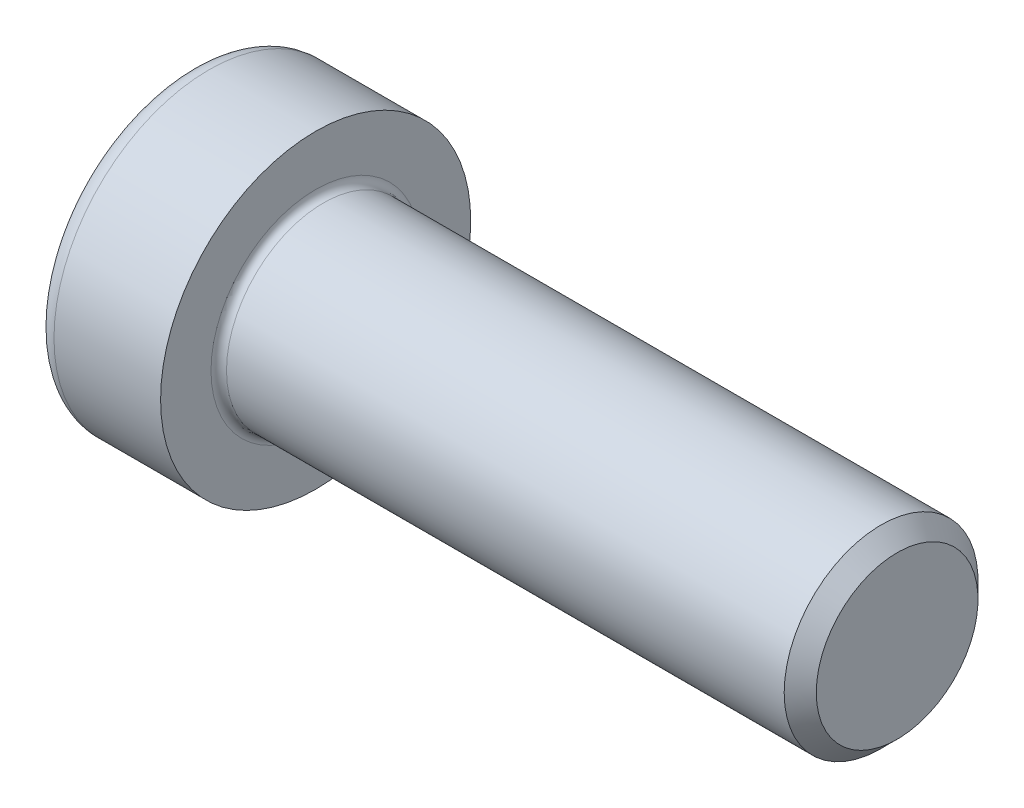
SolidWorks part; units mm, degrees
revolve "Base-Revolve" add sketch "BodySke"
sketch "BodySke" plane through (0, 0, 0) normal (0, 0, 1) x (1, 0, 0)
  line L0 (0, 0) -> (0, 8)
  line L1 (0, 8) -> (6.5, 8)
  line L2 (6.5, 8) -> (6.5, 5)
  line L3 (6.5, 5) -> (35.672, 5)
  line L4 (36.5, 4.172) -> (36.5, 0)
  line L5 (36.5, 0) -> (0, 0)
  line L6 (-31.75, 0) -> (127, 0) construction
  line L8 (36.5, 4.172) -> (35.672, 5)
  line L10 (36.5, -4.172) -> (35.672, -5) construction
  line L11 (8, 4.525) -> (8, -1.825) construction
  line L12 (6.5, 4.525) -> (6.5, -1.825) construction
  line L13 (-23.5, 4.525) -> (-23.5, -1.825) construction
fillet "Fillet1" radius 0.4 1 edges at (6.5, 0, 5)
fillet "Fillet2" radius 1 1 edges at (0, 0, 8)
ref_plane "Plane1" through (0, 0, 0) normal (0, 0, 1) x (1, 0, 0)
ref_plane "Plane2" through (0, 0, 0) normal (0, 1, 0) x (1, 0, 0)
ref_plane "Plane3" through (0, 0, 0) normal (1, 0, 0) x (0, 0, -1)
other "Configuration Table"
sketch "HexSke" plane through (0, 0, 0) normal (-1, 0, 0) x (0, 0.5, 0.866)
  line L0 (2.3599, 4.0875) -> (-2.3599, 4.0875)
  line L1 (-2.3599, 4.0875) -> (-4.7198, 0)
  line L2 (2.3599, 4.0875) -> (4.7198, 0)
  line L3 (2.3599, -4.0875) -> (4.7198, 0)
  line L4 (2.3599, -4.0875) -> (-2.3599, -4.0875)
  line L5 (-2.3599, -4.0875) -> (-4.7198, 0)
extrude "Hex" cut sketch "HexSke" against normal blind 3.65
sketch "PilotSke" plane through (0, 0, 0) normal (0, 0, 1) x (1, 0, 0)
  line L0 (0, 4.0875) -> (3.65, 4.0875)
  line L1 (3.65, 4.0875) -> (4.5449, 2.5375)
  line L2 (-31.75, 0) -> (127, 0) construction
  line L3 (9.325, 0) -> (0, 0)
  line L4 (0, 0) -> (0, 4.0875)
  line L5 (4.5449, 2.5375) -> (7.86, 2.5375)
  line L6 (0, 0) -> (47.625, 0) construction
  line L7 (7.86, 2.5375) -> (9.325, 0)
revolve "Hex-PreBroach" cut sketch "PilotSke" angle 360 about L6
sketch "ThdSchSke" plane through (0, 0, 0) normal (0, 0, 1) x (1, 0, 0)
  line L0 (11, -4.172) -> (10.4202, -5)
  line L1 (11, -4.172) -> (11.5798, -5)
  line L2 (11.5798, -5) -> (11.5798, -6.25)
  line L3 (-3.175, 0) -> (5.1513, 0) construction
  line L4 (0, 7) -> (0, -7) construction
  line L5 (11.5798, -6.25) -> (10.4202, -6.25)
  line L6 (10.4202, -6.25) -> (10.4202, -5)
revolve "ThreadSchematic" [suppressed] cut sketch "ThdSchSke" angle 360 about L3
pattern_linear "ThdSchPat" [suppressed]
equation "\"D2@HexSke\" = \"Hex_size@HexSke\" / 2"
equation "\"D1@HexSke\" = \"Hex_size@HexSke\" / 2"
equation "\"D1@PilotSke\" = \"Hex_size@HexSke\" / 2"
equation "\"Thread_minor@ThreadCosmetic\"  =  \"Minor_dia@BodySke\""
equation "\"Depth@PilotSke\" =  \"Key_eng@Hex\""
equation "\"Thread_length@ThreadCosmetic\" = ((sgn( (\"Length@BodySke\" - \"Advance@BodySke\" * 3.0) - \"Thread_nom@BodySke\" )-1)*( (\"Length@BodySke\" - \"Advance@BodySke\" * 3.0) - \"Thread_nom@BodySke\" ))/-2+ \"Thread_no"
equation "\"Thread_minor@ThdSchSke\" = \"Minor_dia@BodySke\""
equation "\"Diameter@ThdSchSke\" = \"Diameter@BodySke\""
equation "\"Overcut@ThdSchSke\" = \"Diameter@BodySke\" * 1.25"
equation "\"Start@ThdSchSke\" = \"Head_ht@BodySke\" + \"Length@BodySke\" - \"Thread_length@ThreadCosmetic\"  '---Non-countersunk---"
equation "\"Num_threads@ThdSchPat\" = int( \"Thread_length@ThreadCosmetic\" / \"Advance@BodySke\" + 0.999 )  + 1"
equation "\"Advance@ThdSchPat\" = \"Thread_length@ThreadCosmetic\" /  (\"Num_threads@ThdSchPat\" - 1) 'relax it"
equation "\"Num_threads@ThdSchPat\" = \"Num_threads@ThdSchPat\" - sgn( \"Num_threads@ThdSchPat\" - 1) '---chamfered tips only---"
